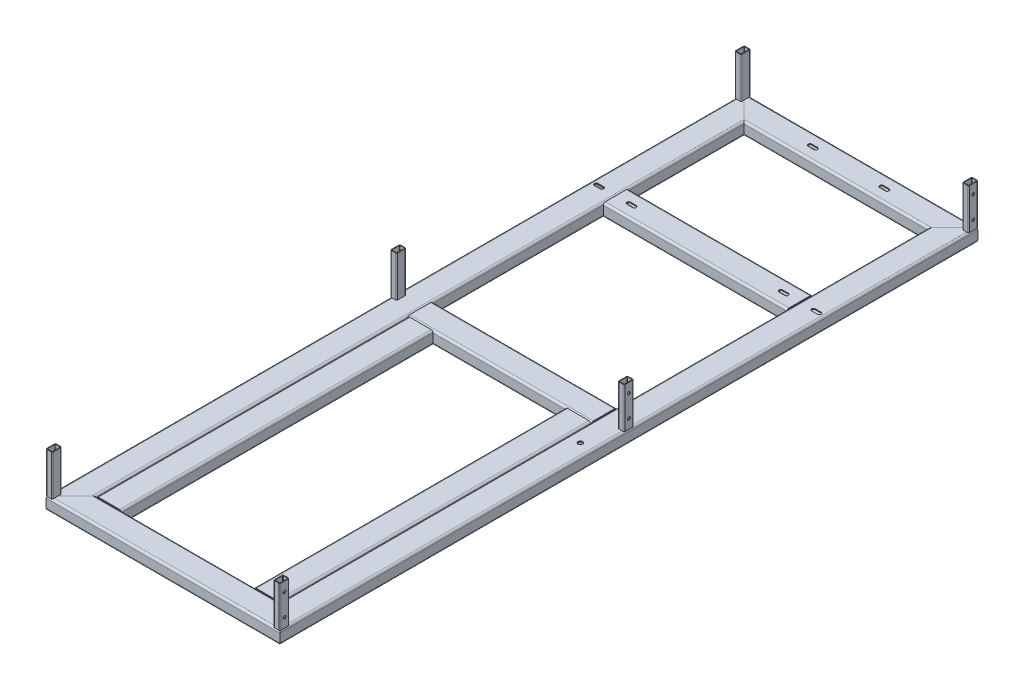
SolidWorks part; units mm, degrees
ref_plane "Piano frontale" through (0, 0, 0) normal (0, 0, 1) x (1, 0, 0)
ref_plane "Piano superiore" through (0, 0, 0) normal (0, 1, 0) x (1, 0, 0)
ref_plane "Piano destro" through (0, 0, 0) normal (1, 0, 0) x (0, 0, -1)
sketch "Schizzo1" plane through (0, 0, 0) normal (0, 1, 0) x (1, 0, 0)
  line L0 (-333.5, 0) -> (333.5, 0)
  line L1 (333.5, -1075) -> (-333.5, -1075)
  line L2 (333.5, -1075) -> (333.5, 1075)
  line L3 (333.5, 1075) -> (-333.5, 1075)
  line L4 (-333.5, -1075) -> (-333.5, 1075)
  line L5 (333.5, -1075) -> (-333.5, 1075) construction
  line L6 (333.5, 1075) -> (-333.5, -1075) construction
  line L7 (-333.5, 625) -> (333.5, 625)
  line L8 (252, 0) -> (252, -1075)
  line L9 (0, 0) -> (0, -1075) construction
  line L10 (-252, 0) -> (-252, -1075)
  point P0 (0, 0)
  dimension "D1" = 2150
  dimension "D2" = 667
  dimension "D3" = 450
  dimension "D4" = 81.5
other "Tubo rettangolare 80 X 40 X 3.0(1)"
ref_plane "Piano1" through (333.5, 0, 1075) normal (-1, 0, 0) x (0, 1, 0)
sketch "Sketch15" plane through (333.5, 0, 1075) normal (-1, 0, 0) x (0, 1, 0)
  line L0 (-13.6, -37) -> (13.6, -37)
  line L1 (-17, -33.6) -> (-17, 33.6)
  line L2 (13.6, 37) -> (-13.6, 37)
  line L3 (17, 33.6) -> (17, -33.6)
  line L4 (-13.6, -40) -> (13.6, -40)
  line L5 (-20, -33.6) -> (-20, 33.6)
  line L6 (13.6, 40) -> (-13.6, 40)
  line L7 (20, 33.6) -> (20, -33.6)
  line L8 (-20, 0) -> (-17, 0) construction
  line L9 (-17, 0) -> (17, 0) construction
  line L10 (17, 0) -> (20, 0) construction
  line L11 (0, 40) -> (0, 37) construction
  line L12 (0, 37) -> (0, -37) construction
  line L13 (0, -37) -> (0, -40) construction
  arc A0 (20, 33.6) -> (13.6, 40) centre (13.6, 33.6) ccw
  arc A1 (13.6, -40) -> (20, -33.6) centre (13.6, -33.6) ccw
  arc A2 (-20, -33.6) -> (-13.6, -40) centre (-13.6, -33.6) ccw
  arc A3 (-13.6, 40) -> (-20, 33.6) centre (-13.6, 33.6) ccw
  arc A4 (-13.6, 37) -> (-17, 33.6) centre (-13.6, 33.6) ccw
  arc A5 (17, 33.6) -> (13.6, 37) centre (13.6, 33.6) ccw
  arc A6 (13.6, -37) -> (17, -33.6) centre (13.6, -33.6) ccw
  arc A7 (-17, -33.6) -> (-13.6, -37) centre (-13.6, -33.6) ccw
  point P6 (-20, 40)
  point P33 (-20, -40)
  point P34 (20, -40)
  point P36 (20, 40)
  point P37 (0, 0)
  dimension "D1" = 6.4
  dimension "Thickness" = 3
  dimension "V_leg" = 80
  dimension "H_leg" = 40
sketch "Schizzo3" plane through (0, 20, 0) normal (0, 1, 0) x (1, 0, 0)
  line L0 (-363.5, 0) -> (363.5, 0) construction
  line L1 (363.5, -1100) -> (-363.5, -1100) construction
  line L2 (363.5, -1100) -> (363.5, 1100) construction
  line L3 (363.5, 1100) -> (-363.5, 1100) construction
  line L4 (-363.5, -1100) -> (-363.5, 1100) construction
  line L5 (363.5, -1100) -> (-363.5, 1100) construction
  line L6 (363.5, 1100) -> (-363.5, -1100) construction
  line L7 (-373.5, 1115) -> (-373.5, -1115) construction
  line L9 (373.5, 1115) -> (-373.5, 1115) construction
  point P0 (0, 0)
  dimension "D1" = 15
  dimension "D2" = 10
sketch3d "Schizzo3D3"
  line L0 (-363.5, 20, 1100) -> (-363.5, 150, 1100)
  line L1 (-363.5, 20, 1100) -> (-363.5, 20, -1100) construction
  line L2 (363.5, 20, 1100) -> (363.5, 150, 1100)
  line L3 (363.5, 20, -1100) -> (363.5, 150, -1100)
  line L4 (-363.5, 20, -1100) -> (-363.5, 150, -1100)
  line L5 (-363.5, 20, 0) -> (-363.5, 150, 0)
  line L6 (363.5, 20, 0) -> (363.5, 150, 0)
  line L7 (363.5, 20, 1100) -> (363.5, 20, -1100) construction
  dimension "D1" = 130
other "Tubo rettangolare 30 X 20 X 2.0(1)"
ref_plane "Piano2" through (-363.5, 20, 1100) normal (0, 1, 0) x (1, 0, 0)
sketch "Sketch11" plane through (-363.5, 20, 1100) normal (0, 1, 0) x (1, 0, 0)
  line L0 (-6.8, -13) -> (6.8, -13)
  line L1 (-8, -11.8) -> (-8, 11.8)
  line L2 (6.8, 13) -> (-6.8, 13)
  line L3 (8, 11.8) -> (8, -11.8)
  line L4 (-6.8, -15) -> (6.8, -15)
  line L5 (-10, -11.8) -> (-10, 11.8)
  line L6 (6.8, 15) -> (-6.8, 15)
  line L7 (10, 11.8) -> (10, -11.8)
  line L8 (-10, 0) -> (-8, 0) construction
  line L9 (-8, 0) -> (8, 0) construction
  line L10 (8, 0) -> (10, 0) construction
  line L11 (0, 15) -> (0, 13) construction
  line L12 (0, 13) -> (0, -13) construction
  line L13 (0, -13) -> (0, -15) construction
  arc A0 (10, 11.8) -> (6.8, 15) centre (6.8, 11.8) ccw
  arc A1 (6.8, -15) -> (10, -11.8) centre (6.8, -11.8) ccw
  arc A2 (-10, -11.8) -> (-6.8, -15) centre (-6.8, -11.8) ccw
  arc A3 (-6.8, 15) -> (-10, 11.8) centre (-6.8, 11.8) ccw
  arc A4 (-6.8, 13) -> (-8, 11.8) centre (-6.8, 11.8) ccw
  arc A5 (8, 11.8) -> (6.8, 13) centre (6.8, 11.8) ccw
  arc A6 (6.8, -13) -> (8, -11.8) centre (6.8, -11.8) ccw
  arc A7 (-8, -11.8) -> (-6.8, -13) centre (-6.8, -11.8) ccw
  point P6 (-10, 15)
  point P33 (-10, -15)
  point P34 (10, -15)
  point P36 (10, 15)
  point P37 (0, 0.5)
  point P38 (0, 0)
  point P40 (0.5, 0)
  point P41 (0, 1)
  point P42 (0, 1.5)
  point P43 (0, 2)
  point P44 (0, 2.5)
  point P45 (0, 3)
  point P46 (0, 3.5)
  point P47 (0, 4)
  point P48 (0, 4.5)
  point P49 (0, 5)
  point P50 (0, 5.5)
  point P51 (0, 6)
  point P52 (0, 6.5)
  point P53 (0, 7)
  point P54 (0, 7.5)
  point P55 (0, 8)
  point P56 (0, 8.5)
  point P57 (0, 9)
  point P58 (0, 9.5)
  point P59 (0, 10)
  point P60 (0, -10)
  point P61 (0, -9.5)
  point P62 (1, 0)
  point P63 (1.5, 0)
  point P64 (2, 0)
  point P65 (2.5, 0)
  point P66 (3, 0)
  point P67 (3.5, 0)
  point P68 (4, 0)
  point P69 (4.5, 0)
  point P70 (5, 0)
  point P71 (5.5, 0)
  point P72 (6, 0)
  point P73 (6.5, 0)
  point P74 (7, 0)
  point P75 (7.5, 0)
  point P76 (8, 0)
  point P77 (8.5, 0)
  point P78 (9, 0)
  point P79 (9.5, 0)
  point P80 (10, 0)
  point P81 (0, -9)
  point P82 (0, -8.5)
  point P83 (0, -8)
  point P84 (0, -7.5)
  point P85 (0, -7)
  point P86 (0, -6.5)
  point P87 (0, -6)
  point P88 (0, -5.5)
  point P89 (0, -5)
  point P90 (0, -4.5)
  point P91 (0, -4)
  point P92 (0, -3.5)
  point P93 (0, -3)
  point P94 (0, -2.5)
  point P95 (0, -2)
  point P96 (0, -1.5)
  point P97 (0, -1)
  point P98 (0, -0.5)
  point P99 (-10, 0)
  point P100 (-9.5, 0)
  point P101 (-9, 0)
  point P102 (-8.5, 0)
  point P103 (-8, 0)
  point P104 (-7.5, 0)
  point P105 (-7, 0)
  point P106 (-6.5, 0)
  point P107 (-6, 0)
  point P108 (-5.5, 0)
  point P109 (-5, 0)
  point P110 (-4.5, 0)
  point P111 (-4, 0)
  point P112 (-3.5, 0)
  point P113 (-3, 0)
  point P114 (-2.5, 0)
  point P115 (-2, 0)
  point P116 (-1.5, 0)
  point P117 (-1, 0)
  point P118 (-0.5, 0)
sketch "Schizzo11" [suppressed] plane through (0, 20, 0) normal (0, 1, 0) x (1, 0, 0)
  line L0 (373.5, 790) -> (-373.5, 790) construction
  line L1 (323.5, -790) -> (-323.5, -790) construction
  line L2 (323.5, -790) -> (323.5, 790) construction
  line L3 (323.5, 790) -> (-323.5, 790) construction
  line L4 (-323.5, -790) -> (-323.5, 790) construction
  line L5 (323.5, -790) -> (-323.5, 790) construction
  line L6 (323.5, 790) -> (-323.5, -790) construction
  line L7 (-353.5, 763.2) -> (-353.5, 786.8) construction
  line L8 (-323.5, -40) -> (323.5, -40) construction
  line L9 (293.5, -40) -> (-293.5, -40) construction
  point P0 (0, 0)
  dimension "D1" = 30
sketch3d "Schizzo3D11" [suppressed]
  line L0 (-323.5, 20, 40) -> (-323.5, 47.5, 40) construction
  line L1 (-323.5, 20, 790) -> (-323.5, 20, -790) construction
  line L2 (323.5, 20, 40) -> (323.5, 47.5, 40) construction
  line L3 (323.5, 20, 790) -> (323.5, 47.5, 790) construction
  line L4 (-323.5, 20, 790) -> (-323.5, 47.5, 790) construction
  line L6 (-323.5, 47.5, 790) -> (-323.5, 47.5, 40)
  line L7 (323.5, 47.5, 790) -> (323.5, 47.5, 40)
  line L8 (-323.5, 30, 790) -> (-323.5, 30, 40)
  line L9 (323.5, 30, 790) -> (323.5, 30, 40)
  dimension "D1" = 27.5
  dimension "D2" = 10
  dimension "D3" = 10
other "Tubo rettangolare 60 X 20 X 2.0(1)"
ref_plane "Piano3" through (-323.5, 30, 790) normal (0, 0, -1) x (0, -1, 0)
sketch "Sketch13" plane through (-323.5, 30, 790) normal (0, 0, -1) x (0, -1, 0)
  line L0 (-6.8, -28) -> (6.8, -28)
  line L1 (-8, -26.8) -> (-8, 26.8)
  line L2 (6.8, 28) -> (-6.8, 28)
  line L3 (8, 26.8) -> (8, -26.8)
  line L4 (-6.8, -30) -> (6.8, -30)
  line L5 (-10, -26.8) -> (-10, 26.8)
  line L6 (6.8, 30) -> (-6.8, 30)
  line L7 (10, 26.8) -> (10, -26.8)
  line L8 (-10, 0) -> (-8, 0) construction
  line L9 (-8, 0) -> (8, 0) construction
  line L10 (8, 0) -> (10, 0) construction
  line L11 (0, 30) -> (0, 28) construction
  line L12 (0, 28) -> (0, -28) construction
  line L13 (0, -28) -> (0, -30) construction
  arc A0 (10, 26.8) -> (6.8, 30) centre (6.8, 26.8) ccw
  arc A1 (6.8, -30) -> (10, -26.8) centre (6.8, -26.8) ccw
  arc A2 (-10, -26.8) -> (-6.8, -30) centre (-6.8, -26.8) ccw
  arc A3 (-6.8, 30) -> (-10, 26.8) centre (-6.8, 26.8) ccw
  arc A4 (-6.8, 28) -> (-8, 26.8) centre (-6.8, 26.8) ccw
  arc A5 (8, 26.8) -> (6.8, 28) centre (6.8, 26.8) ccw
  arc A6 (6.8, -28) -> (8, -26.8) centre (6.8, -26.8) ccw
  arc A7 (-8, -26.8) -> (-6.8, -28) centre (-6.8, -26.8) ccw
  point P6 (-10, 30)
  point P33 (-10, -30)
  point P34 (10, -30)
  point P36 (10, 30)
  point P37 (0, 0)
other "Tubo rettangolare 60 X 15 X 2.0(1)"
ref_plane "Piano4" through (-323.5, 47.5, 790) normal (0, 0, -1) x (0, -1, 0)
sketch "Sketch14" plane through (-323.5, 47.5, 790) normal (0, 0, -1) x (0, -1, 0)
  line L0 (-4.3, -28) -> (4.3, -28)
  line L1 (-5.5, -26.8) -> (-5.5, 26.8)
  line L2 (4.3, 28) -> (-4.3, 28)
  line L3 (5.5, 26.8) -> (5.5, -26.8)
  line L4 (-4.3, -30) -> (4.3, -30)
  line L5 (-7.5, -26.8) -> (-7.5, 26.8)
  line L6 (4.3, 30) -> (-4.3, 30)
  line L7 (7.5, 26.8) -> (7.5, -26.8)
  line L8 (-7.5, 0) -> (-5.5, 0) construction
  line L9 (-5.5, 0) -> (5.5, 0) construction
  line L10 (5.5, 0) -> (7.5, 0) construction
  line L11 (0, 30) -> (0, 28) construction
  line L12 (0, 28) -> (0, -28) construction
  line L13 (0, -28) -> (0, -30) construction
  arc A0 (7.5, 26.8) -> (4.3, 30) centre (4.3, 26.8) ccw
  arc A1 (4.3, -30) -> (7.5, -26.8) centre (4.3, -26.8) ccw
  arc A2 (-7.5, -26.8) -> (-4.3, -30) centre (-4.3, -26.8) ccw
  arc A3 (-4.3, 30) -> (-7.5, 26.8) centre (-4.3, 26.8) ccw
  arc A4 (-4.3, 28) -> (-5.5, 26.8) centre (-4.3, 26.8) ccw
  arc A5 (5.5, 26.8) -> (4.3, 28) centre (4.3, 26.8) ccw
  arc A6 (4.3, -28) -> (5.5, -26.8) centre (4.3, -26.8) ccw
  arc A7 (-5.5, -26.8) -> (-4.3, -28) centre (-4.3, -26.8) ccw
  point P6 (-7.5, 30)
  point P33 (-7.5, -30)
  point P34 (7.5, -30)
  point P36 (7.5, 30)
  point P37 (0, 0)
sketch "Schizzo12" plane through (0, 20, 0) normal (0, 1, 0) x (1, 0, 0)
  line L0 (-333.5, 1075) -> (333.5, 1075) construction
  line L1 (-299.9, 1041.4) -> (-367.1, 1108.6) construction
  line L2 (367.1, 1108.6) -> (299.9, 1041.4) construction
  line L3 (-114.45, 1081) -> (-114.45, 1069) construction
  line L4 (-105.45, 1081) -> (-123.45, 1081) construction
  line L5 (-123.45, 1069) -> (-105.45, 1069) construction
  line L6 (-105.45, 1075) -> (-123.45, 1075) construction
  line L7 (-105.45, 1069) -> (-123.45, 1069)
  line L8 (-105.45, 1081) -> (-123.45, 1081)
  arc A0 (-105.45, 1069) -> (-105.45, 1081) centre (-105.45, 1075) ccw
  arc A1 (-123.45, 1081) -> (-123.45, 1069) centre (-123.45, 1075) ccw
  point P14 (-114.45, 1075)
  point P20 (-129.45, 1075)
  point P21 (-99.45, 1075)
  point P22 (114.45, 1075)
  point P23 (-346.95, 625)
  point P25 (-243.05, 625)
  point P27 (243.05, 625)
  point P29 (346.95, 625)
  dimension "D1" = 6
  dimension "D2" = 30
extrude "Taglio-Estrusione3" cut sketch "Schizzo12" against normal up to surface (40 mm away)
pattern_sketch "Ripetizione-Schizzo2" of "Taglio-Estrusione3"
sketch "Schizzo13" plane through (0, -20, 0) normal (0, -1, 0) x (1, 0, 0)
  line L0 (-333.5, 1075) -> (333.5, 1075) construction
  line L1 (-299.9, 1041.4) -> (-367.1, 1108.6) construction
  line L2 (299.9, 1041.4) -> (367.1, 1108.6) construction
  line L4 (-373.5, -1115) -> (-373.5, 1115) construction
  line L6 (0, 1115) -> (0, 1035) construction
  line L7 (-373.5, 1115) -> (373.5, 1115) construction
  line L8 (-293.5, 1035) -> (293.5, 1035) construction
  line L9 (-373.5, 0) -> (373.5, 0) construction
  line L10 (373.5, 1115) -> (373.5, -1115) construction
  line L11 (-333.5, -1075) -> (333.5, -1075) construction
  line L13 (-299.9, -1041.4) -> (-367.1, -1108.6) construction
  line L14 (299.9, -1041.4) -> (367.1, -1108.6) construction
  circle A0 centre (-303.5, 1075) radius 5.5
  point P10 (333.5, 0)
  point P27 (303.5, -1075)
  point P28 (303.5, 1075)
  point P30 (-303.5, -1075)
  point P41 (-333.5, 0)
  dimension "D1" = 11
  dimension "D2" = 70
  dimension "D3" = 70
extrude "Taglio-Estrusione4" cut sketch "Schizzo13" against normal blind 10
pattern_sketch "Ripetizione-Schizzo3" of "Taglio-Estrusione4"
sketch "Schizzo14" plane through (373.5, 0, 0) normal (1, 0, 0) x (0, 0, -1)
  line L0 (-1100, 150) -> (-1100, 20) construction
  line L1 (-1111.8, 150) -> (-1088.2, 150) construction
  line L2 (-1111.8, 20) -> (-1088.2, 20) construction
  line L3 (1100, 150) -> (1100, 20) construction
  line L4 (1088.2, 150) -> (1111.8, 150) construction
  line L5 (1088.2, 20) -> (1111.8, 20) construction
  line L6 (0, 150) -> (0, 20) construction
  line L7 (-11.8, 150) -> (11.8, 150) construction
  line L8 (-1108.6, 20) -> (1108.6, 20) construction
  circle A0 centre (-1100, 120) radius 4.5
  point P8 (-1100, 50)
  point P9 (1100, 120)
  point P16 (0, 120)
  point P18 (1100, 50)
  point P24 (0, 50)
  dimension "D1" = 9
  dimension "D2" = 30
  dimension "D3" = 30
extrude "Taglio-Estrusione5" cut sketch "Schizzo14" against normal blind 10
pattern_sketch "Ripetizione-Schizzo4" of "Taglio-Estrusione5"
sketch "Schizzo15" plane through (-373.5, 0, 0) normal (-1, 0, 0) x (0, 0, 1)
  line L0 (-1108.6, 20) -> (1108.6, 20) construction
  line L1 (-1100, 150) -> (-1100, 20) construction
  line L2 (-1111.8, 150) -> (-1088.2, 150) construction
  line L3 (-1111.8, 20) -> (-1088.2, 20) construction
  line L4 (0, 150) -> (0, 20) construction
  line L5 (-11.8, 150) -> (11.8, 150) construction
  line L6 (-11.8, 20) -> (11.8, 20) construction
  circle A1 centre (1100, 120) radius 4.5
  circle A2 centre (1100, 120) radius 4.5
  point P0 (1100, 50)
  point P7 (-1100, 50)
  point P8 (-1100, 120)
  point P15 (0, 120)
  point P16 (0, 50)
  dimension "D2" = 30
  dimension "D1" = 0
extrude "Taglio-Estrusione6" cut sketch "Schizzo15" against normal blind 10
pattern_sketch "Ripetizione-Schizzo5" of "Taglio-Estrusione6"
sketch "Schizzo5" plane through (0, 0, 0) normal (1, 0, 0) x (0, 0, -1)
  line L0 (625, 20) -> (625, -20) construction
  line L1 (631, 20) -> (619, 20) construction
  line L2 (0, 17) -> (0, -13.6) construction
  line L3 (-33.6, 17) -> (33.6, 17) construction
  line L4 (1035, -13.6) -> (-1035, -13.6) construction
  line L5 (619, -20) -> (631, -20) construction
  circle A0 centre (0, 0) radius 10
  circle A1 centre (625, 0) radius 10
  dimension "D1" = 20
extrude "Taglio-Estrusione1" cut sketch "Schizzo5" against normal mid plane 667
sketch "Schizzo6" plane through (0, 20, 0) normal (0, 1, 0) x (1, 0, 0)
  line L0 (355.8515, -1087.3515) -> (371.1485, -1112.6485) construction
  line L1 (355.8515, -1112.6485) -> (371.1485, -1087.3515) construction
  line L2 (0, 0) -> (0, -1115) construction
  line L3 (-373.5, -1115) -> (373.5, -1115) construction
  line L4 (0, 0) -> (373.5, 0) construction
  line L5 (373.5, -1115) -> (373.5, 1115) construction
  line L6 (-353.5, 0) -> (-373.5, 0) construction
  line L7 (-353.5, -11.8) -> (-353.5, 11.8) construction
  line L8 (-373.5, 11.8) -> (-373.5, -11.8) construction
  arc A0 (356.7, -1087) -> (355.5, -1088.2) centre (356.7, -1088.2) ccw construction
  arc A1 (370.3, -1113) -> (371.5, -1111.8) centre (370.3, -1111.8) ccw construction
  arc A2 (355.5, -1111.8) -> (356.7, -1113) centre (356.7, -1111.8) ccw construction
  arc A3 (371.5, -1088.2) -> (370.3, -1087) centre (370.3, -1088.2) ccw construction
  circle A4 centre (363.5, -1095) radius 3
  circle A5 centre (-363.5, -1095) radius 3
  circle A6 centre (-363.5, 1095) radius 3
  circle A7 centre (363.5, 1095) radius 3
  circle A8 centre (-363.5, 0) radius 3
  circle A9 centre (363.5, 0) radius 3
  point P23 (363.5, -1100)
  dimension "D1" = 6
  dimension "D2" = 5
extrude "Taglio-Estrusione2" cut sketch "Schizzo6" against normal blind 4
sketch "Schizzo16" plane through (0, 0, 0) normal (0, 0, 1) x (1, 0, 0)
  line L0 (-252, 20) -> (-252, -20) construction
  line L1 (-218.4, 20) -> (-285.6, 20) construction
  line L2 (-218.4, -20) -> (-285.6, -20) construction
  line L3 (0, 0) -> (0, 20) construction
  line L4 (293.5, 20) -> (-293.5, 20) construction
  circle A0 centre (-252, 0) radius 10
  circle A1 centre (252, 0) radius 10
  dimension "D1" = 20
extrude "Taglio-Estrusione7" cut sketch "Schizzo16" along normal blind 1000
sketch "Schizzo17" plane through (0, 0, 1035) normal (0, 0, -1) x (-1, 0, 0)
  line L0 (0, 0) -> (-120, 0) construction
  circle A0 centre (-120, 0) radius 7.5
  dimension "D1" = 15
  dimension "D2" = 120
extrude "Taglio-Estrusione8" cut sketch "Schizzo17" against normal blind 10
sketch "Schizzo18" plane through (0, 20, 0) normal (0, 1, 0) x (1, 0, 0)
  line L0 (333.5, 1075) -> (333.5, -115) construction
  line L1 (299.9, 1041.4) -> (367.1, 1108.6) construction
  circle A0 centre (333.5, -115) radius 7.5
  dimension "D1" = 15
  dimension "D2" = 1190
extrude "Taglio-Estrusione9" cut sketch "Schizzo18" against normal blind 10
equation "\"D1@Sketch11\"=\"Thickness@Sketch11\"*1.6"
equation "\"D1@Sketch13\"=1.6*\"Thickness@Sketch13\""
equation "\"D1@Sketch14\"=1.6*\"Thickness@Sketch14\""
